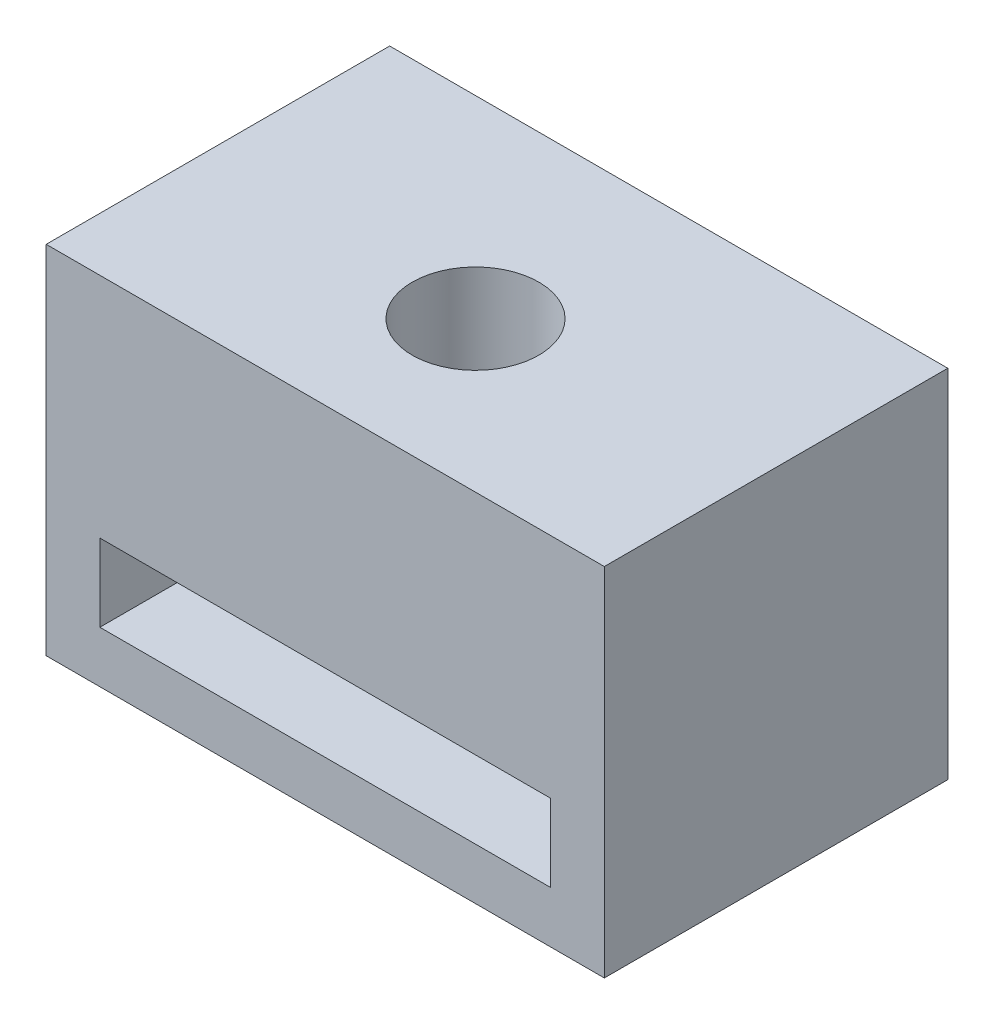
SolidWorks part; units mm, degrees
ref_plane "Plan de face" through (0, 0, 0) normal (0, 0, 1) x (1, 0, 0)
ref_plane "Plan de dessus" through (0, 0, 0) normal (0, 1, 0) x (1, 0, 0)
ref_plane "Plan de droite" through (0, 0, 0) normal (1, 0, 0) x (0, 0, -1)
sketch "Esquisse1" plane through (0, 0, 0) normal (0, 0, 1) x (1, 0, 0)
  line L0 (6.5, 2.1) -> (6.5, 8.3) construction
  line L1 (0, 0) -> (13, 0)
  line L2 (0, 0) -> (0, 8.3)
  line L3 (0, 8.3) -> (13, 8.3)
  line L4 (13, 0) -> (13, 8.3)
  line L6 (1.25, 1.2) -> (11.75, 1.2)
  line L7 (1.25, 1.2) -> (1.25, 3)
  line L8 (1.25, 3) -> (11.75, 3)
  line L9 (11.75, 1.2) -> (11.75, 3)
  line L10 (1.25, 1.2) -> (11.75, 3) construction
  line L11 (1.25, 3) -> (11.75, 1.2) construction
  point P7 (6.5, 2.1)
  dimension "D1" = 8.3
  dimension "D2" = 13
  dimension "D3" = 10.5
  dimension "D4" = 1.8
  dimension "D5" = 5.3
  dimension "D6" = 1.2
extrude "Boss.-Extru.1" add sketch "Esquisse1" along normal blind 8
sketch "Esquisse2" plane through (0, 8.3, 0) normal (0, 1, 0) x (1, 0, 0)
  line L0 (6.5, -8) -> (6.5, -4.5) construction
  line L1 (13, -8) -> (0, -8) construction
  circle A0 centre (6.5, -4.5) radius 1.475
  dimension "D2" = 2.95
  dimension "D1" = 3.5
extrude "Enlèv. mat.-Extru.1" cut sketch "Esquisse2" against normal through all
